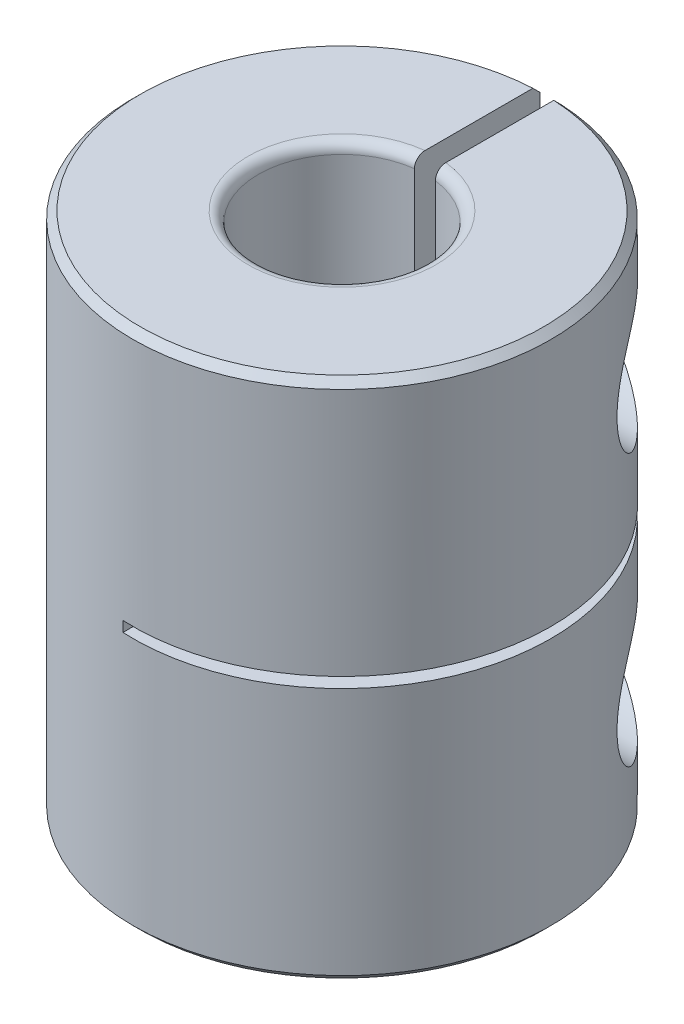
SolidWorks part; units mm, degrees
ref_plane "Front Plane" through (0, 0, 0) normal (0, 0, 1) x (1, 0, 0)
ref_plane "Top Plane" through (0, 0, 0) normal (0, 1, 0) x (1, 0, 0)
ref_plane "Right Plane" through (0, 0, 0) normal (1, 0, 0) x (0, 0, -1)
other "Center of Mass"
sketch "Sketch1" plane through (0, 0, 0) normal (0, 1, 0) x (1, 0, 0)
  circle A0 centre (0, 0) radius 10
  dimension "D1" = 20
extrude "Boss-Extrude1" add sketch "Sketch1" along normal blind 25
sketch "Sketch2" plane through (0, 25, 0) normal (0, 1, 0) x (1, 0, 0)
  circle A0 centre (0, 0) radius 4
  dimension "D1" = 8
extrude "Cut-Extrude1" cut sketch "Sketch2" against normal blind 12.5
sketch "Sketch3" plane through (0, 0, 0) normal (0, -1, 0) x (1, 0, 0)
  circle A0 centre (0, 0) radius 2.5
  dimension "D1" = 5
extrude "Cut-Extrude2" cut sketch "Sketch3" against normal blind 12.5
fillet "Fillet1" radius 0.5 2 edges at (0, 0, -2.5) (0, 25, 4)
chamfer "Chamfer2" distance 0.5 angle 45 1 edges at (0, 12.5, -2.5)
chamfer "Chamfer3" distance 0.35 angle 45 2 edges at (0, 0, 10) (0, 25, 10)
ref_plane "Plane1" through (10, 0, 0) normal (-1, 0, 0) x (0, 0, 1)
ref_plane "Plane2" through (-10, 0, 0) normal (1, 0, 0) x (0, 0, -1)
ref_plane "Plane3" through (0, 0, 10) normal (0, 0, -1) x (-1, 0, 0)
ref_plane "Plane4" through (0, 0, -10) normal (0, 0, 1) x (1, 0, 0)
sketch "Sketch4" plane through (10, 0, 0) normal (-1, 0, 0) x (0, 0, 1)
  line L1 (4, -25) -> (-4, -25) construction
  line L2 (4, -25) -> (4, 25) construction
  line L3 (4, 25) -> (-4, 25) construction
  line L4 (-4, -25) -> (-4, 25) construction
  line L5 (4, -25) -> (-4, 25) construction
  line L6 (4, 25) -> (-4, -25) construction
  line L8 (-4, 19) -> (-10, 19) construction
  line L9 (-10, -11) -> (-10, 11) construction
  line L10 (0, 25) -> (0, 0) construction
  line L11 (4.5, 25) -> (-4.5, 25) construction
  line L12 (0, 12.5) -> (-10, 12.5) construction
  circle A0 centre (-7, 19) radius 3
  circle A1 centre (-7, 6) radius 3
  point P0 (0, 0)
  point P15 (0, 0)
  point P18 (0, 0)
  point P19 (0, 0)
  point P20 (0, 12.5)
  point P21 (-10, 12.5251)
  point P22 (0, 0)
  point P23 (0, 0)
  point P24 (0, 0)
  point P25 (0, 0)
  point P26 (0, 0)
  point P27 (0, 0)
  point P28 (0, 0)
  point P29 (0, 23.9514)
  point P30 (0, 0)
  point P31 (0, 0)
  point P32 (0, 0)
  point P33 (0, 0)
  point P34 (0, 0)
  point P35 (0, 0)
  point P36 (0, 0)
  point P37 (0, 0)
  point P38 (0, 0)
  point P39 (0, 0)
  point P40 (0, 0)
  point P41 (-4, 25.1354)
  point P42 (0, 0)
  point P43 (0, 0)
  point P44 (0, 0)
  point P45 (-4, 25)
  dimension "D4" = 6
  dimension "D1" = 50
  dimension "D2" = 8
  dimension "D3" = 6
extrude "Cut-Extrude3" cut sketch "Sketch4" along normal blind 8
sketch "Sketch5" plane through (2, 0, 0) normal (1, 0, 0) x (0, 0, -1)
  circle A1 centre (7, 19) radius 1.25
  circle A2 centre (7, 6) radius 1.25
  dimension "D1" = 2.5
  dimension "D2" = 2.5
extrude "Cut-Extrude4" cut sketch "Sketch5" against normal through all
sketch "Sketch6" plane through (0, 0, -10) normal (0, 0, 1) x (1, 0, 0)
  line L0 (0, 0) -> (0, 25) construction
  line L1 (4.5, 25) -> (-4.5, 25) construction
  line L2 (0.5, 0) -> (0.5, 25)
  line L3 (-0.5, 0) -> (-0.5, 25)
  line L4 (0.5, 25) -> (-0.5, 25)
  line L5 (0.5, 0) -> (-0.5, 0)
  dimension "D1" = 0.5
  dimension "D2" = 0.5
extrude "Cut-Extrude5" cut sketch "Sketch6" along normal blind 13.95
sketch "Sketch7" plane through (10, 0, 0) normal (-1, 0, 0) x (0, 0, 1)
  line L0 (10.0065, 12.5) -> (-10, 12.5) construction
  line L1 (-10, -11) -> (-10, 11) construction
  line L3 (9.65, 25) -> (-9.637, 25) construction
  line L4 (0.0065, 25) -> (0, 0) construction
  line L5 (10.0065, 12.75) -> (-10, 12.75)
  line L6 (10.0065, 12.25) -> (-10, 12.25)
  line L7 (-10, 12.75) -> (-10, 12.25)
  line L10 (10.0065, 12.25) -> (10.0065, 12.75)
  point P2 (0.0032, 12.5)
  dimension "D1" = 0.25
  dimension "D2" = 0.25
extrude "Cut-Extrude6" cut sketch "Sketch7" along normal up to surface (10.5 mm away)
sketch "Sketch8" plane through (0, 12.25, 0) normal (0, 1, 0) x (1, 0, 0)
  arc A1 (-0.5, 3.9686) -> (0.5, 3.9686) centre (0, 0) ccw construction
  circle A2 centre (0, 0) radius 4
  point P3 (0.4018, 3.9686)
extrude "Cut-Extrude7" cut sketch "Sketch8" along normal blind 13.975
